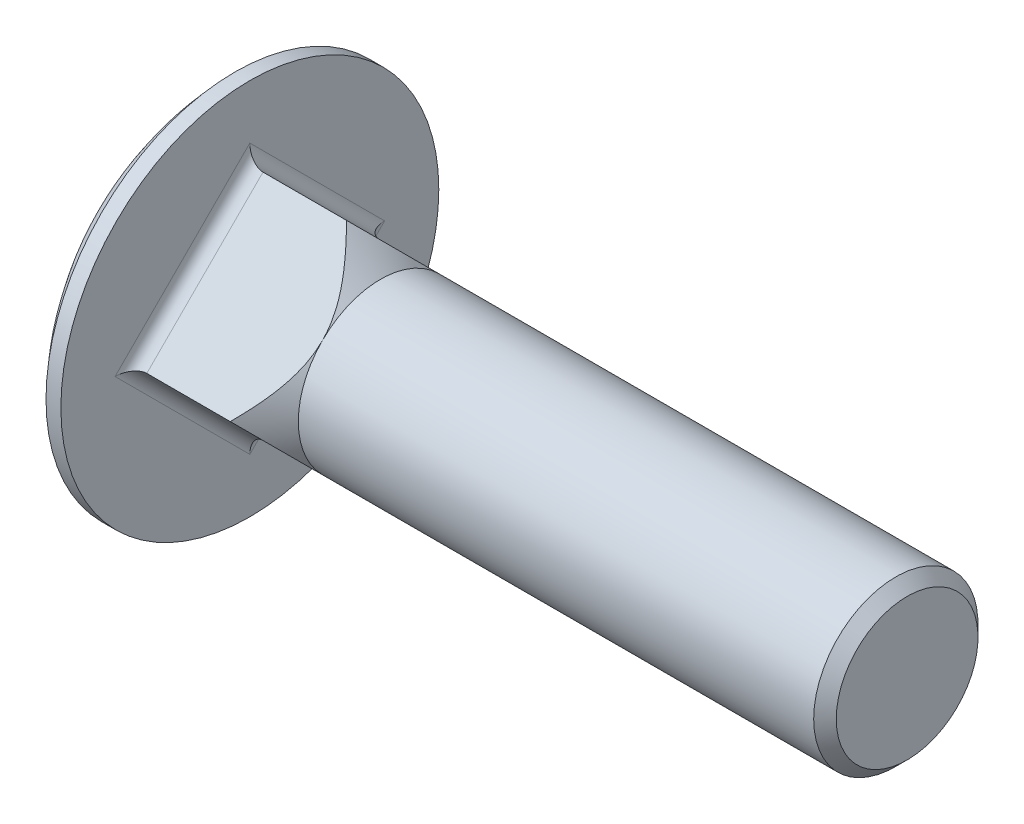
SolidWorks part; units mm, degrees
ref_plane "Plane1" through (0, 0, 0) normal (0, 0, 1) x (1, 0, 0)
ref_plane "Plane2" through (0, 0, 0) normal (0, 1, 0) x (1, 0, 0)
ref_plane "Plane3" through (0, 0, 0) normal (1, 0, 0) x (0, 0, -1)
sketch "BodySke" plane through (0, 0, 0) normal (0, 0, 1) x (1, 0, 0)
  line L1 (9.0906, 23) -> (10.9, 23)
  line L2 (10.9, 23) -> (10.9, 10)
  line L3 (10.9, 10) -> (89.526, 10)
  line L4 (90.9, 8.626) -> (90.9, 0)
  line L5 (90.9, 0) -> (0, 0)
  line L6 (-31.75, 0) -> (127, 0) construction
  line L8 (90.9, 8.626) -> (89.526, 10)
  line L10 (90.9, -8.626) -> (89.526, -10) construction
  line L11 (13.4, 7.799) -> (13.4, 1.449) construction
  line L12 (30.9, 7.799) -> (30.9, 1.449) construction
  line L13 (30.9, 7.799) -> (30.9, 1.449) construction
  arc A0 (9.0906, 23) -> (0, 0) centre (33.6413, 0) ccw
  dimension "D1" = 1.8094
  dimension "Diameter" = 20
  dimension "Head_ht" = 10.9
  dimension "Length" = 80
  dimension "Body_ch_ang" = 45
  dimension "Head_dia" = 46
  dimension "Minor_dia" = 17.252
  dimension "Advance" = 2.5
  dimension "Thread_nom" = 60
  dimension "Thread_length" = 60
revolve "Base-Revolve" add sketch "BodySke" angle 360 about L6
sketch "Sketch1" plane through (10.9, 0, 0) normal (1, 0, 0) x (0, 0, -1)
  line L0 (0, 14.1421) -> (14.1421, 0)
  line L1 (14.1421, 0) -> (0, -14.1421)
  line L2 (0, -14.1421) -> (-14.1421, 0)
  line L3 (-14.1421, 0) -> (0, 14.1421)
  circle A0 centre (0, 0) radius 10 construction
  circle A1 centre (0, 0) radius 23 construction
  dimension "D1" = 20
extrude "Boss-Extrude1" add sketch "Sketch1" along normal blind 15.9
sketch "Sketch2" plane through (0, 0, 0) normal (0, 0, 1) x (1, 0, 0)
  line L0 (0, 0) -> (101.6, 0) construction
  line L1 (26.8, 10) -> (31.8, 10)
  line L2 (26.8, 10) -> (12.8, 24)
  line L3 (31.8, 10) -> (31.8, 24)
  line L4 (31.8, 24) -> (12.8, 24)
  dimension "D1" = 20
  dimension "D2" = 26.8
  dimension "D3" = 48
  dimension "D4" = 5
  dimension "D5" = 45
revolve "Cut-Revolve1" cut sketch "Sketch2" angle 360 about L0
fillet "Fillet1" radius 1.6 4 edges at (10.9, 7.0711, -7.0711) (10.9, -7.0711, -7.0711) (10.9, 7.0711, 7.0711) (10.9, -7.0711, 7.0711)
sketch "ThdSchSke" plane through (0, 0, 0) normal (0, 0, 1) x (1, 0, 0)
  line L0 (30.9, -8.626) -> (29.9379, -10)
  line L1 (30.9, -8.626) -> (31.8621, -10)
  line L2 (31.8621, -10) -> (31.8621, -12.5)
  line L3 (0, 0) -> (5.1513, 0) construction
  line L5 (31.8621, -12.5) -> (29.9379, -12.5)
  line L6 (29.9379, -12.5) -> (29.9379, -10)
  arc A0 (9.0906, 23) -> (9.0906, -23) centre (33.6413, 0) ccw construction
  dimension "Thread_minor" = 17.252
  dimension "Diameter" = 20
  dimension "Start" = 30.9
  dimension "SideAngle" = 55
  dimension "VeeAngle" = 70
  dimension "Overcut" = 25
revolve "ThreadSchematic" [suppressed] cut sketch "ThdSchSke" angle 360 about L3
pattern_linear "ThdSchPat" [suppressed]
equation "\"Thread_minor@ThreadCosmetic\"  =  \"Minor_dia@BodySke\""
equation "\"Thread_length@ThreadCosmetic\" = ((sgn( (\"Length@BodySke\" - \"Advance@BodySke\" * 3.0) - \"Thread_nom@BodySke\" )-1)*( (\"Length@BodySke\" - \"Advance@BodySke\" * 3.0) - \"Thread_nom@BodySke\" ))/-2+ \"Thread_no"
equation "\"Thread_minor@ThdSchSke\" = \"Minor_dia@BodySke\""
equation "\"Diameter@ThdSchSke\" = \"Diameter@BodySke\""
equation "\"Overcut@ThdSchSke\" = \"Diameter@BodySke\" * 1.25"
equation "\"Start@ThdSchSke\" = \"Head_ht@BodySke\" + \"Length@BodySke\" - \"Thread_length@ThreadCosmetic\"  '---Non-countersunk---"
equation "\"Num_threads@ThdSchPat\" = int( \"Thread_length@ThreadCosmetic\" / \"Advance@BodySke\" + 0.999 )  + 1"
equation "\"Advance@ThdSchPat\" = \"Thread_length@ThreadCosmetic\" /  (\"Num_threads@ThdSchPat\" - 1) 'relax it"
equation "\"Num_threads@ThdSchPat\" = \"Num_threads@ThdSchPat\" - sgn( \"Num_threads@ThdSchPat\" - 1) '---chamfered tips only---"
equation "\"D1@BodySke\" = \"Head_ht@BodySke\" * .166"
equation "\"D1@Sketch2\" = \"Diameter@Bodyske\""
equation "\"D2@Sketch2\" = \"Head_ht@Bodyske\" + \"NeckHt@Boss-extrude1\""
equation "\"D3@Sketch2\" = \"Head_dia@Bodyske\" + 2"
equation "\"D1@Sketch1\" = \"Diameter@Bodyske\""
